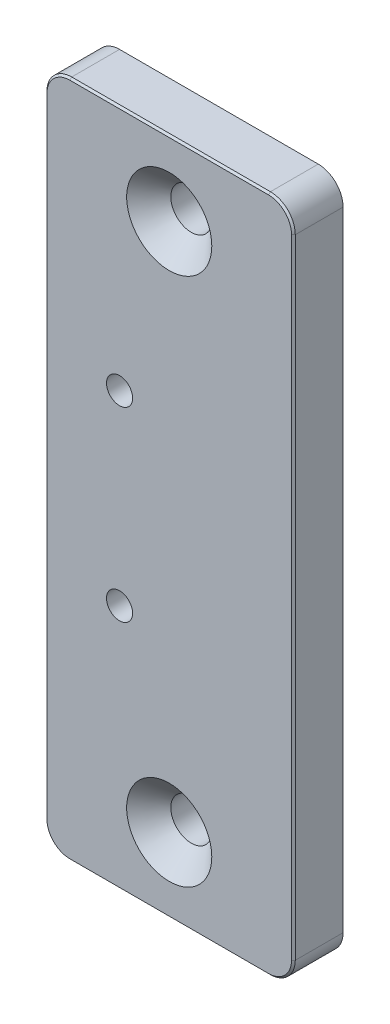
SolidWorks part; units mm, degrees
ref_plane "Ebene vorne" through (0, 0, 0) normal (0, 0, 1) x (1, 0, 0)
ref_plane "Ebene oben" through (0, 0, 0) normal (0, 1, 0) x (1, 0, 0)
ref_plane "Ebene rechts" through (0, 0, 0) normal (1, 0, 0) x (0, 0, -1)
sketch "Skizze2" plane through (0, 0, 0) normal (0, 0, 1) x (1, 0, 0)
  line L4 (-16, 0) -> (16, 0)
  line L5 (20, 4) -> (20, 105.2)
  line L6 (16, 109.2) -> (-16, 109.2)
  line L7 (-20, 105.2) -> (-20, 4)
  line L16 (0, 0) -> (0, 51.4989) construction
  line L21 (0, 0) -> (-103.9375, 0) construction
  circle A60 centre (0, 97.2) radius 3.3
  circle A71 centre (0, 12) radius 3.3
  arc A72 (16, 0) -> (20, 4) centre (16, 4) ccw
  arc A73 (20, 105.2) -> (16, 109.2) centre (16, 105.2) ccw
  arc A74 (-16, 109.2) -> (-20, 105.2) centre (-16, 105.2) ccw
  arc A75 (-20, 4) -> (-16, 0) centre (-16, 4) ccw
  dimension "D9" = 4
  dimension "D12" = 6.6
  dimension "D13" = 6.6
  dimension "D1" = 109.2
  dimension "D2" = 40
  dimension "D8" = 109.2
  dimension "D10" = 12
  dimension "D11" = 12
extrude "Aufsatz-Linear austragen1" add sketch "Skizze2" along normal blind 8
hole_wizard "Formsenkung für M6 Senkschraube mit Innensechskant1" positions "Skizze5" profile "Skizze6" countersink size "M6" standard "DIN"
sketch "Skizze5" plane through (0, 0, 8) normal (0, 0, 1) x (1, 0, 0)
  point P0 (0, 97.2)
  point P3 (0, 12)
sketch "Skizze6" plane through (0, 97.2, 8) normal (1, 0, 0) x (0, -1, 0)
  line L0 (0, 0) -> (0, 13.4828)
  line L1 (0, 13.4828) -> (3.3, 11.5)
  line L2 (3.3, 11.5) -> (3.3, 3.555)
  line L3 (3.3, 3.555) -> (6.855, 0)
  line L5 (6.855, 0) -> (0, 0)
  line L6 (-3.3, 3.555) -> (-6.855, 0) construction
  line L10 (0, 13.4828) -> (-3.3, 11.5) construction
  line L11 (0, -6.35) -> (0, 107.95) construction
  dimension "Bohrerdurchmesser" = 6.6
  dimension "Bohrungstiefe" = 11.5
  dimension "Senkdurchmesser (Oben)" = 13.71
  dimension "Senkwinkel (Oben)" = 90
  dimension "Spitzenwinkel" = 118
chamfer "Fase1" distance 0.3 angle 45 8 edges at (20, 54.6, 8) (18.8284, 108.0284, 8) (18.8284, 1.1716, 8) (0, 109.2, 8) (0, 0, 8) (-18.8284, 108.0284, 8) (-18.8284, 1.1716, 8) (-20, 54.6, 8)
hole_wizard "M5 Gewindebohrung2" positions "Skizze7" profile "Skizze8" tap size "M5" standard "DIN"
sketch "Skizze7" plane through (0, 0, 8) normal (0, 0, 1) x (1, 0, 0)
  line L0 (-8, 69.6) -> (-8, 39.6) construction
  line L3 (-32.1021, 54.6) -> (31.0327, 54.6) construction
  line L5 (-16, 109.2) -> (16, 109.2) construction
  line L6 (16, 0) -> (-16, 0) construction
  line L9 (-20, 105.2) -> (-20, 4) construction
  point P0 (-8, 69.6)
  point P2 (-8, 39.6)
  point P5 (-8, 69.6)
  point P6 (-8, 39.6)
  dimension "D1" = 30
  dimension "D2" = 12
sketch "Skizze8" plane through (-8, 69.6, 8) normal (1, 0, 0) x (0, -1, 0)
  line L0 (0, 0) -> (0, 15.2618)
  line L1 (0, 15.2618) -> (2.1, 14)
  line L2 (2.1, 14) -> (2.1, 0)
  line L5 (2.1, 0) -> (0, 0)
  line L10 (0, 15.2618) -> (-2.1, 14) construction
  line L11 (0, -6.35) -> (0, 107.95) construction
  dimension "Bohrerdurchmesser" = 4.2
  dimension "Bohrungstiefe" = 14
  dimension "Spitzenwinkel" = 118
